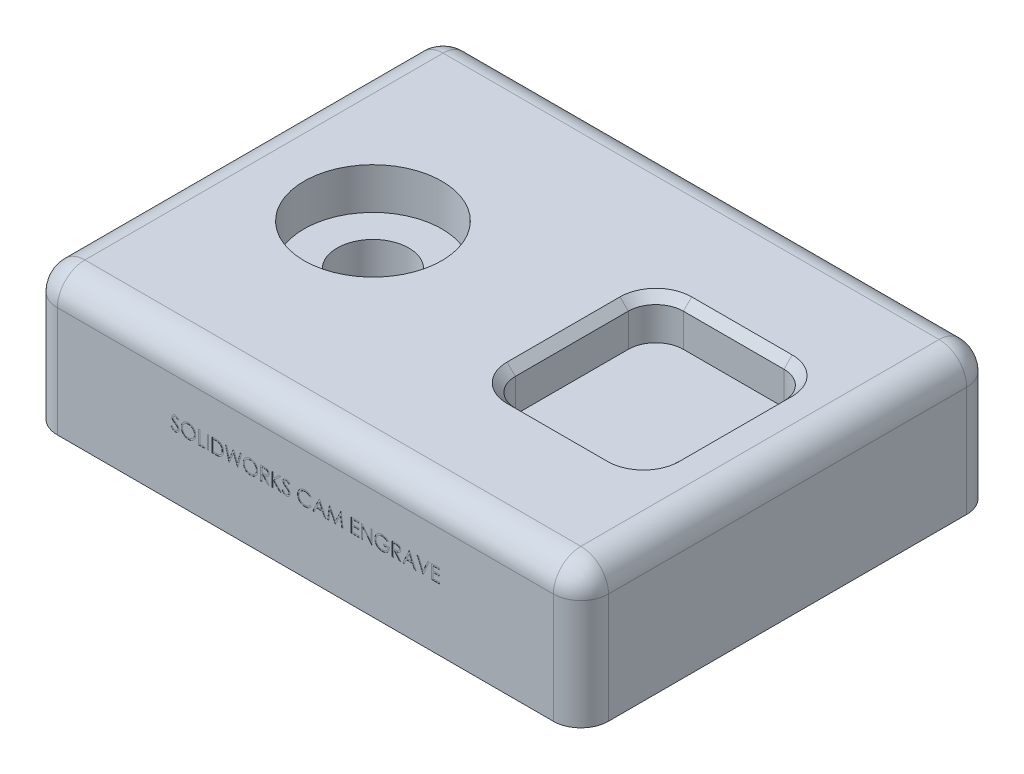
SolidWorks part; units mm, degrees
ref_plane "Front Plane" through (0, 0, 0) normal (0, 0, 1) x (1, 0, 0)
ref_plane "Top Plane" through (0, 0, 0) normal (0, 1, 0) x (1, 0, 0)
ref_plane "Right Plane" through (0, 0, 0) normal (1, 0, 0) x (0, 0, -1)
sketch "Sketch1" plane through (0, 0, 0) normal (0, 1, 0) x (1, 0, 0)
  line L1 (-100, -75) -> (100, -75)
  line L2 (-100, -75) -> (-100, 75)
  line L3 (-100, 75) -> (100, 75)
  line L4 (100, -75) -> (100, 75)
  line L5 (-100, -75) -> (100, 75) construction
  line L6 (-100, 75) -> (100, -75) construction
  point P0 (0, 0)
  dimension "D1" = 200
  dimension "D2" = 150
extrude "Boss-Extrude1" add sketch "Sketch1" along normal blind 50
sketch "Engrave_Position" plane through (0, 0, 75) normal (0, 0, 1) x (1, 0, 0)
  line L0 (-100, 25) -> (100, 25) construction
  line L1 (-100, 50) -> (-100, 0) construction
  line L2 (100, 50) -> (100, 0) construction
  line L3 (-100, 22.5) -> (100, 22.5) construction
  dimension "D1" = 2.5
sketch "Engrave_Sketch" plane through (0, 0, 75) normal (0, 0, 1) x (1, 0, 0)
  text T0 "SOLIDWORKS CAM ENGRAVE" font "Century Gothic" height 5
extrude "Engrave" cut sketch "Engrave_Sketch" against normal blind 0.05
sketch "Sketch4" plane through (0, 50, 0) normal (0, 1, 0) x (1, 0, 0)
  line L0 (-100, 0) -> (0, -0.9217) construction
  line L3 (0, -76.8433) -> (0, 75) construction
  line L4 (100, 75) -> (-100, 75) construction
  line L5 (-100, 75) -> (-100, -75) construction
  line L6 (0, -0.9217) -> (100, 0) construction
  line L7 (100, -75) -> (100, 75) construction
  circle A0 centre (-50, -0.4608) radius 25
  dimension "D1" = 50
extrude "Cut-Extrude3" cut sketch "Sketch4" against normal blind 15
hole_wizard "CBORE for M16 SHCS1" positions "Sketch5" profile "Sketch6" counterbore size "M16" standard "ANSI Metric"
sketch "Sketch5" plane through (0, 35, 0) normal (0, 1, 0) x (1, 0, 0)
  point P0 (-50, -0.4608)
sketch "Sketch6" plane through (-50, 35, 0.4608) normal (1, 0, 0) x (0, 0, 1)
  line L0 (0, 0) -> (0, 35)
  line L1 (0, 35) -> (9.5, 35)
  line L3 (9.5, 35) -> (9.5, 16)
  line L4 (9.5, 16) -> (13, 16)
  line L5 (13, 16) -> (13, 0)
  line L7 (13, 0) -> (0, 0)
  line L11 (0, -6.35) -> (0, 107.95) construction
  dimension "Thru Hole Dia." = 19
  dimension "Thru Hole Depth" = 35
  dimension "C'Bore Dia." = 26
  dimension "C'Bore Depth" = 16
sketch "Sketch7" plane through (0, 50, 0) normal (0, 1, 0) x (1, 0, 0)
  line L1 (21.6986, -30.5028) -> (78.1928, -30.5028)
  line L2 (21.6986, -30.5028) -> (21.6986, 30.5028)
  line L3 (21.6986, 30.5028) -> (78.1928, 30.5028)
  line L4 (78.1928, -30.5028) -> (78.1928, 30.5028)
  line L5 (21.6986, -30.5028) -> (78.1928, 30.5028) construction
  line L6 (21.6986, 30.5028) -> (78.1928, -30.5028) construction
  point P0 (49.9457, 0)
extrude "Pocket" cut sketch "Sketch7" against normal blind 15
fillet "Fillet1" radius 10 8 edges at (-100, 25, -75) (-100, 25, 75) (100, 25, 75) (100, 25, -75) (78.1928, 42.5, 30.5028) (78.1928, 42.5, -30.5028) (21.6986, 42.5, -30.5028) (21.6986, 42.5, 30.5028)
fillet "Fillet2" radius 10 8 edges at (-97.0711, 50, 72.0711) (-100, 50, 0) (-97.0711, 50, -72.0711) (0, 50, -75) (97.0711, 50, -72.0711) (100, 50, 0) (97.0711, 50, 72.0711) (0, 50, 75)
chamfer "Chamfer1" distance 3 angle 45 8 edges at (78.1928, 50, 0) (75.2639, 50, -27.5739) (75.2639, 50, 27.5739) (49.9457, 50, -30.5028) (49.9457, 50, 30.5028) (24.6275, 50, -27.5739) (24.6275, 50, 27.5739) (21.6986, 50, 0)
